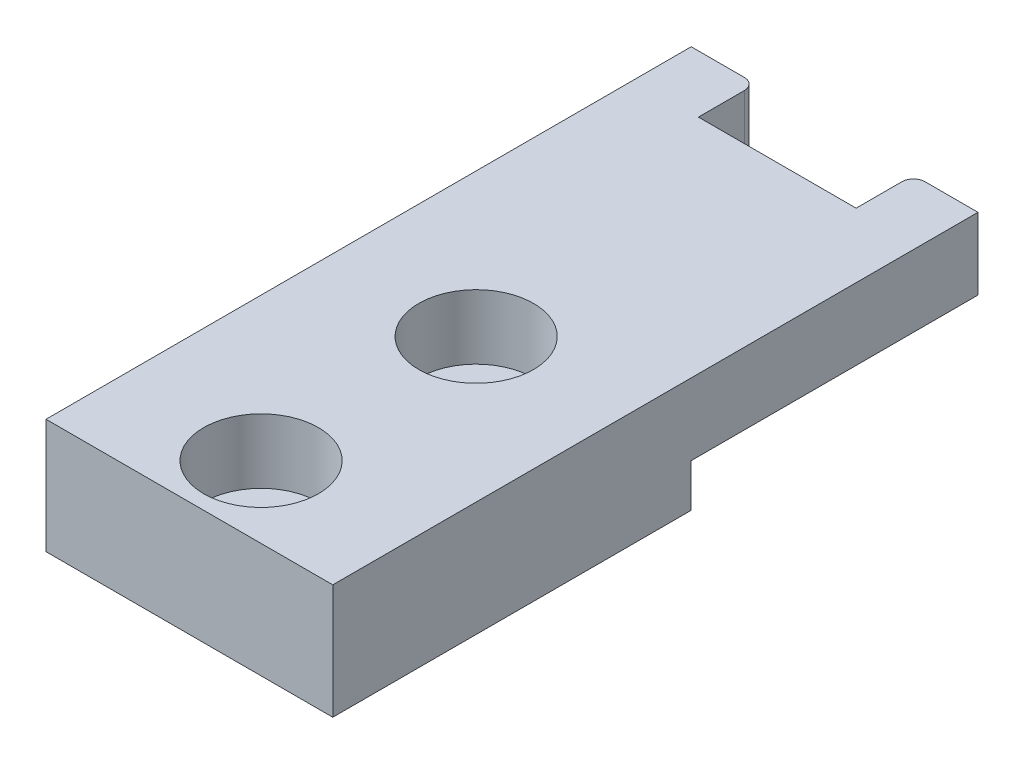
SolidWorks part; units mm, degrees
ref_plane "前视基准面" through (0, 0, 0) normal (0, 0, 1) x (1, 0, 0)
ref_plane "上视基准面" through (0, 0, 0) normal (0, 1, 0) x (1, 0, 0)
ref_plane "右视基准面" through (0, 0, 0) normal (1, 0, 0) x (0, 0, -1)
sketch "草图1" plane through (0, 0, 0) normal (0, 0, 1) x (1, 0, 0)
  line L0 (0, 8) -> (20, 8)
  line L1 (20, 0) -> (20, 8)
  line L2 (0, 0) -> (0, 8)
  line L3 (0, 0) -> (20, 0)
extrude "凸台-拉伸1" add sketch "草图1" along normal blind 45
sketch "草图2" plane through (0, 8, 0) normal (0, 1, 0) x (1, 0, 0)
  line L0 (4.5, -4) -> (4.5, -0.8)
  line L1 (15.5, -4) -> (15.5, -0.8)
  line L2 (20, -45) -> (20, 0)
  line L3 (0, -45) -> (0, 0)
  line L4 (0, 0) -> (3.7, 0)
  line L5 (4.5, -4) -> (15.5, -4)
  line L6 (0, -45) -> (20, -45)
  line L7 (16.3, 0) -> (20, 0)
  arc A0 (4.5, -0.8) -> (3.7, 0) centre (3.7, -0.8) ccw
  arc A1 (16.3, 0) -> (15.5, -0.8) centre (16.3, -0.8) ccw
  circle A2 centre (10, -25) radius 2.25
  circle A3 centre (10, -40) radius 2.25
extrude "切除-拉伸1" cut sketch "草图2" against normal blind 45 flip side to cut
sketch "草图3" plane through (0, 8, 0) normal (0, 1, 0) x (1, 0, 0)
  circle A0 centre (10, -25) radius 4
  circle A1 centre (10, -40) radius 4
extrude "切除-拉伸2" cut sketch "草图3" against normal blind 4.5
sketch "草图4" plane through (20, 0, 0) normal (1, 0, 0) x (0, 0, -1)
  line L0 (-20, 3) -> (0, 3)
  line L1 (-20, 0) -> (-20, 3)
extrude "切除-拉伸3" cut sketch "草图4" against normal through all and the other way through all flip side to cut
